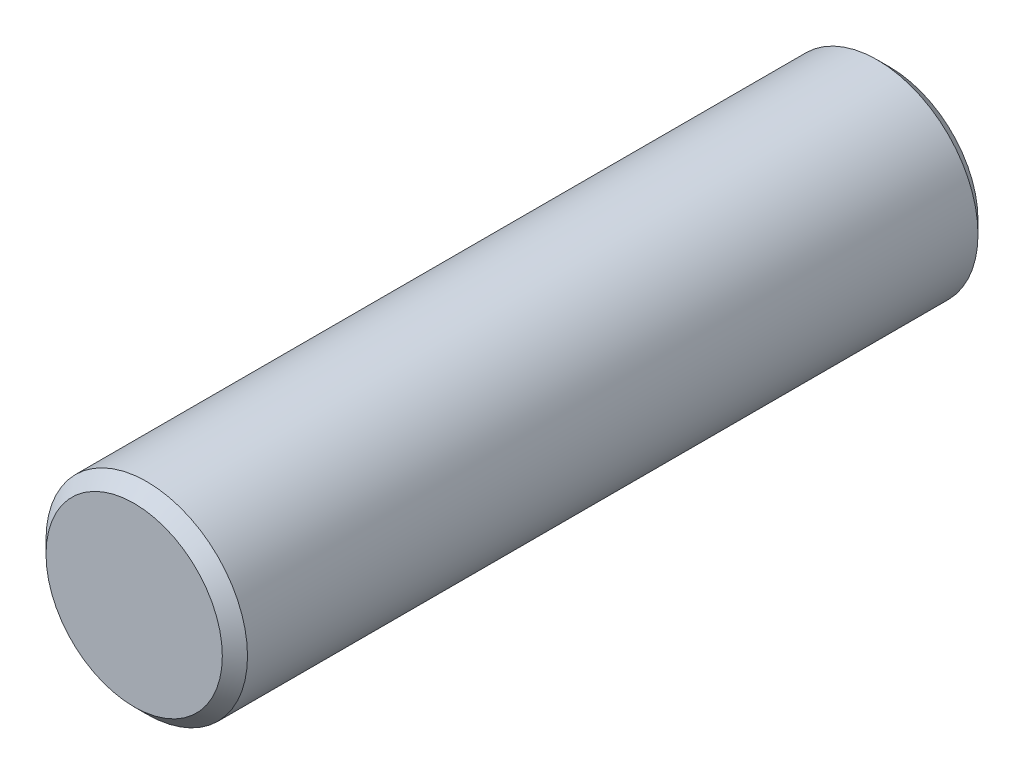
SolidWorks part; units mm, degrees
ref_plane "正面" through (0, 0, 0) normal (0, 0, 1) x (1, 0, 0)
ref_plane "平面" through (0, 0, 0) normal (0, 1, 0) x (1, 0, 0)
ref_plane "右側面" through (0, 0, 0) normal (1, 0, 0) x (0, 0, -1)
sketch "ｽｹｯﾁ1" plane through (0, 0, 0) normal (0, 0, 1) x (1, 0, 0)
  circle A0 centre (0, 0) radius 4
  dimension "D1" = 8
extrude "ﾎﾞｽ - 押し出し1" add sketch "ｽｹｯﾁ1" along normal blind 30
chamfer "面取り1" distance 0.5 angle 45 2 edges at (4, 0, 0) (4, 0, 30)
